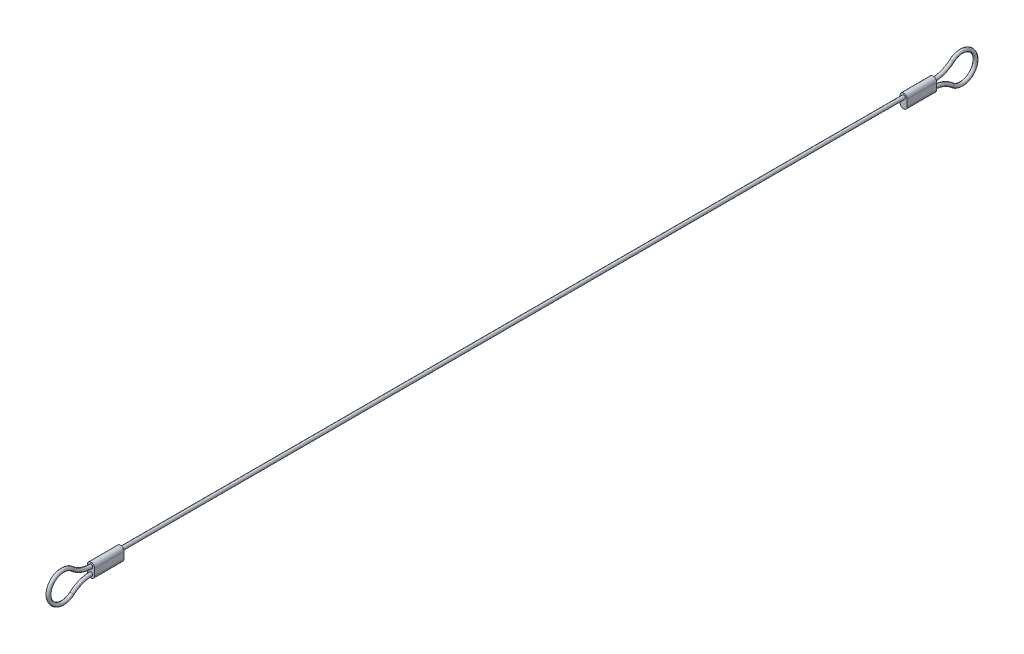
SolidWorks part; units mm, degrees
ref_plane "Front Plane" through (0, 0, 0) normal (0, 0, 1) x (1, 0, 0)
ref_plane "Top Plane" through (0, 0, 0) normal (0, 1, 0) x (1, 0, 0)
ref_plane "Right Plane" through (0, 0, 0) normal (1, 0, 0) x (0, 0, -1)
sketch "Sketch1" plane through (0, 0, 0) normal (1, 0, 0) x (0, 0, -1)
  line L0 (142.8, 0) -> (-142.8, 0)
  line L1 (0, 1.32) -> (0, -1.32) construction
  arc A0 (-142.8, 0) -> (-149.2, 2.4446) centre (-142.8, 9.6) cw
  arc A1 (-149.2, 2.4446) -> (-149.2, -4.7108) centre (-152.4, -1.1331) ccw
  arc A2 (-149.2, -4.7108) -> (-142.8, -2.2663) centre (-142.8, -11.8663) cw
  arc A3 (149.2, -4.7108) -> (142.8, -2.2663) centre (142.8, -11.8663) ccw
  arc A4 (149.2, 2.4446) -> (149.2, -4.7108) centre (152.4, -1.1331) cw
  arc A5 (142.8, 0) -> (149.2, 2.4446) centre (142.8, 9.6) ccw
  point P18 (0, 0)
  dimension "D1" = 4.8
  dimension "D4" = 9.6
  dimension "D2" = 152.4
  dimension "D3" = 9.6
sketch "Sketch2" plane through (0, 0, 0) normal (0, 0, 1) x (1, 0, 0)
  circle A0 centre (0, 0) radius 0.595
  dimension "D1" = 1.19
sweep "Sweep1" add profiles "Sketch2" path "Sketch1"
sketch "Sketch3" plane through (0, 0, 142.8) normal (0, 0, -1) x (-1, 0, 0)
  line L0 (0, 0) -> (0, -2.2663) construction
  line L1 (1.2, 0) -> (1.2, -2.2663)
  line L2 (-1.2, 0) -> (-1.2, -2.2663)
  line L3 (-0.595, -2.2663) -> (0.595, -2.2663) construction
  arc A0 (1.2, 0) -> (-1.2, 0) centre (0, 0) ccw
  arc A1 (-1.2, -2.2663) -> (1.2, -2.2663) centre (0, -2.2663) ccw
  point P3 (0, -1.1331)
  dimension "D1" = 2.4
extrude "Boss-Extrude1" add sketch "Sketch3" along normal blind 10
mirror "Mirror1" about plane through (0, 0, 0) normal (0, 0, 1) of "Boss-Extrude1"
